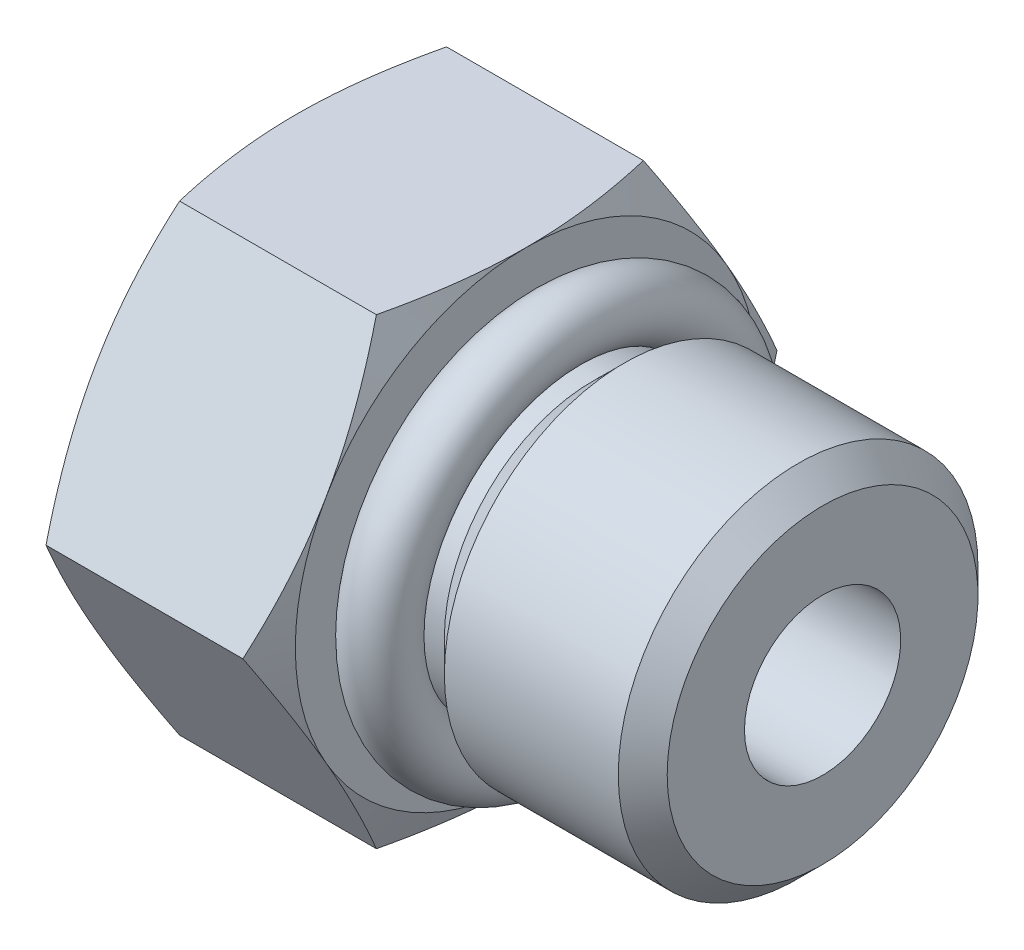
SolidWorks part; units mm, degrees
ref_plane "Front Plane" through (0, 0, 0) normal (0, 0, 1) x (1, 0, 0)
ref_plane "Top Plane" through (0, 0, 0) normal (0, 1, 0) x (1, 0, 0)
ref_plane "Right Plane" through (0, 0, 0) normal (1, 0, 0) x (0, 0, -1)
imported_body "Imported1"
sketch "Sketch1" plane through (-16.256, 0, 0) normal (-1, 0, 0) x (0, 0, 1)
  circle A0 centre (0, 0) radius 10.5525
extrude "Cut-Extrude1" cut sketch "Sketch1" along normal through all
hole_wizard "1/8 NPT Tapped Hole1" positions "Sketch3" profile "Sketch2" size "1/8" standard "Ansi Inch"
sketch "Sketch3" plane through (-16.256, 0, 0) normal (-1, 0, 0) x (0, 0, 1)
  point P0 (0, 0)
sketch "Sketch2" plane through (-16.256, 0, 0) normal (0, 1, 0) x (0, 0, 1)
  line L0 (0, 0) -> (0, 11.1695)
  line L1 (4.2164, 8.636) -> (0, 11.1695)
  line L2 (-4.2164, 8.636) -> (0, 11.1695) construction
  line L3 (4.2164, 8.636) -> (4.2164, 6.35)
  line L4 (4.2164, 6.35) -> (4.5374, 6.35)
  line L5 (4.5374, 6.35) -> (4.7275, 0)
  line L6 (-4.5374, 6.35) -> (-4.7275, 0) construction
  line L7 (4.7275, 0) -> (0, 0)
  line L8 (0, -6.35) -> (0, 107.95) construction
  line L11 (-4.2164, 6.35) -> (-4.5374, 6.35) construction
  dimension "Tap Drill Dia." = 8.4328
  dimension "Tap Drill Depth" = 8.636
  dimension "Thread Dia." = 9.4551
  dimension "Thread Angle" = 3.43
  dimension "Thread Depth" = 6.35
  dimension "Drill Angle" = 118
